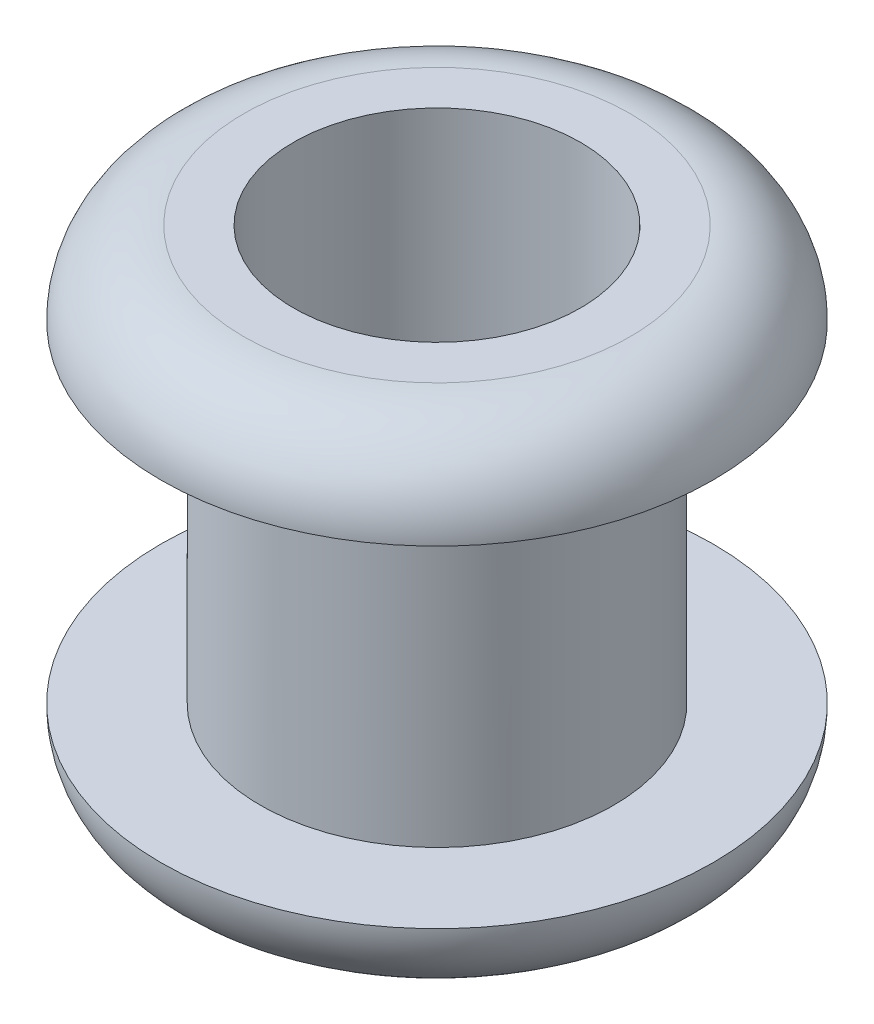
SolidWorks part; units mm, degrees
ref_plane "Front" through (0, 0, 0) normal (0, 0, 1) x (1, 0, 0)
ref_plane "Top" through (0, 0, 0) normal (0, 1, 0) x (1, 0, 0)
ref_plane "Right" through (0, 0, 0) normal (1, 0, 0) x (0, 0, -1)
sketch "Sketch1" plane through (0, 0, 0) normal (0, 1, 0) x (1, 0, 0)
  circle A0 centre (0, 0) radius 1.6
  circle A1 centre (0, 0) radius 1.3
  dimension "D1" = 3.2
  dimension "D2" = 0.3
extrude "Extrude1" add sketch "Sketch1" along normal blind 3
sketch "Sketch2" plane through (0, 3, 0) normal (0, 1, 0) x (-1, 0, 0)
  circle A0 centre (0, 0) radius 2.5
extrude "Extrude2" add sketch "Sketch2" along normal blind 0.75
sketch "Sketch3" plane through (0, 0, 0) normal (0, -1, 0) x (1, 0, 0)
  circle A0 centre (0, 0) radius 2.5
extrude "Extrude3" add sketch "Sketch3" along normal blind 0.75
sketch "Sketch4" plane through (0, -0.75, 0) normal (0, -1, 0) x (1, 0, 0)
  circle A0 centre (0, 0) radius 1.3
extrude "Cut-Extrude1" cut sketch "Sketch4" against normal through all
fillet "Fillet1" radius 0.75 2 edges at (0, -0.75, -2.5) (0, 3.75, 2.5)
